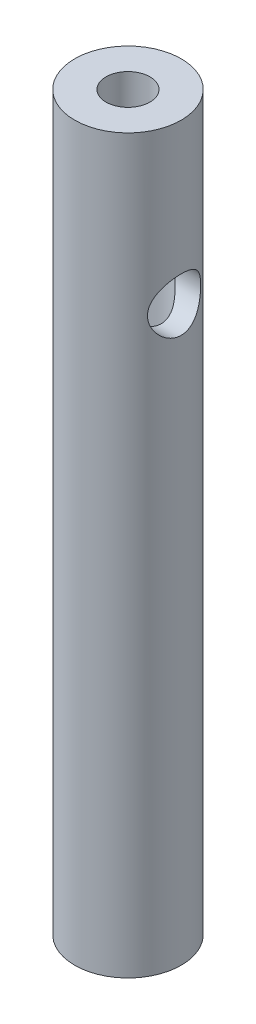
SolidWorks part; units mm, degrees
ref_plane "Front Plane" through (0, 0, 0) normal (0, 0, 1) x (1, 0, 0)
ref_plane "Top Plane" through (0, 0, 0) normal (0, 1, 0) x (1, 0, 0)
ref_plane "Right Plane" through (0, 0, 0) normal (1, 0, 0) x (0, 0, -1)
sketch "Sketch1" plane through (0, 0, 0) normal (0, 1, 0) x (1, 0, 0)
  circle A0 centre (0, 0) radius 4
  dimension "D1" = 8
extrude "Boss-Extrude1" add sketch "Sketch1" along normal blind 55
hole_wizard "M4 Tapped Hole1" positions "Sketch3" profile "Sketch4" tap size "M4" standard "DIN"
sketch "Sketch3" plane through (0, 55, 0) normal (0, 1, 0) x (1, 0, 0)
  point P0 (0, 0)
sketch "Sketch4" plane through (0, 55, 0) normal (1, 0, 0) x (0, 0, 1)
  line L0 (0, 0) -> (0, 10.9914)
  line L1 (0, 10.9914) -> (1.65, 10)
  line L2 (1.65, 10) -> (1.65, 0)
  line L5 (1.65, 0) -> (0, 0)
  line L10 (0, 10.9914) -> (-1.65, 10) construction
  line L11 (0, -6.35) -> (0, 107.95) construction
  dimension "Tap Drill Dia." = 3.3
  dimension "Tap Drill Depth" = 10
  dimension "Drill Angle" = 118
hole_wizard "Ø4.0 (4) Diameter Hole1" positions "3DSketch1" profile "Sketch7" hole size "Ø4.0" standard "ISO"
sketch3d "3DSketch1"
  line L0 (0, 0, 0) -> (4, 0, 0)
  line L3 (4, 0, 0) -> (4, 43, 0)
  point P0 (4, 43, 0)
  dimension "D1" = 4
  dimension "D2" = 43
sketch "Sketch7" plane through (4, 43, 0) normal (0, 1, 0) x (0, 0, -1)
  line L0 (0, 0) -> (0, 5.2017)
  line L1 (0, 5.2017) -> (2, 4)
  line L2 (2, 4) -> (2, 0)
  line L5 (2, 0) -> (0, 0)
  line L10 (0, 5.2017) -> (-2, 4) construction
  line L11 (0, -6.35) -> (0, 107.95) construction
  dimension "Hole Dia." = 4
  dimension "Hole Depth" = 4
  dimension "Drill Angle" = 118
hole_wizard "M6 Tapped Hole1" positions "Sketch9" profile "Sketch8" tap size "M6" standard "DIN"
sketch "Sketch9" plane through (0, 0, 0) normal (0, -1, 0) x (-1, 0, 0)
  point P0 (0, 0)
sketch "Sketch8" plane through (0, 0, 0) normal (1, 0, 0) x (0, 0, -1)
  line L0 (0, 0) -> (0, 11.5022)
  line L1 (0, 11.5022) -> (2.5, 10)
  line L2 (2.5, 10) -> (2.5, 0)
  line L5 (2.5, 0) -> (0, 0)
  line L10 (0, 11.5022) -> (-2.5, 10) construction
  line L11 (0, -6.35) -> (0, 107.95) construction
  dimension "Tap Drill Dia." = 5
  dimension "Tap Drill Depth" = 10
  dimension "Drill Angle" = 118
hole_wizard "Ø5.0 (5) Diameter Hole1" positions "Sketch6" profile "Sketch5" hole size "Ø5.0" standard "ISO"
sketch "Sketch6" plane through (0, 0, 0) normal (0, -1, 0) x (-1, 0, 0)
  point P0 (0, 0)
sketch "Sketch5" plane through (0, 0, 0) normal (1, 0, 0) x (0, 0, -1)
  line L0 (0, 0) -> (0, 46.5022)
  line L1 (0, 46.5022) -> (2.5, 45)
  line L2 (2.5, 45) -> (2.5, 0)
  line L5 (2.5, 0) -> (0, 0)
  line L10 (0, 46.5022) -> (-2.5, 45) construction
  line L11 (0, -6.35) -> (0, 107.95) construction
  dimension "Hole Dia." = 5
  dimension "Hole Depth" = 45
  dimension "Drill Angle" = 118
sketch "Sketch10" plane through (0, 0, 0) normal (0, 0, 1) x (1, 0, 0)
  line L0 (0, 0) -> (10.4739, 0) construction
